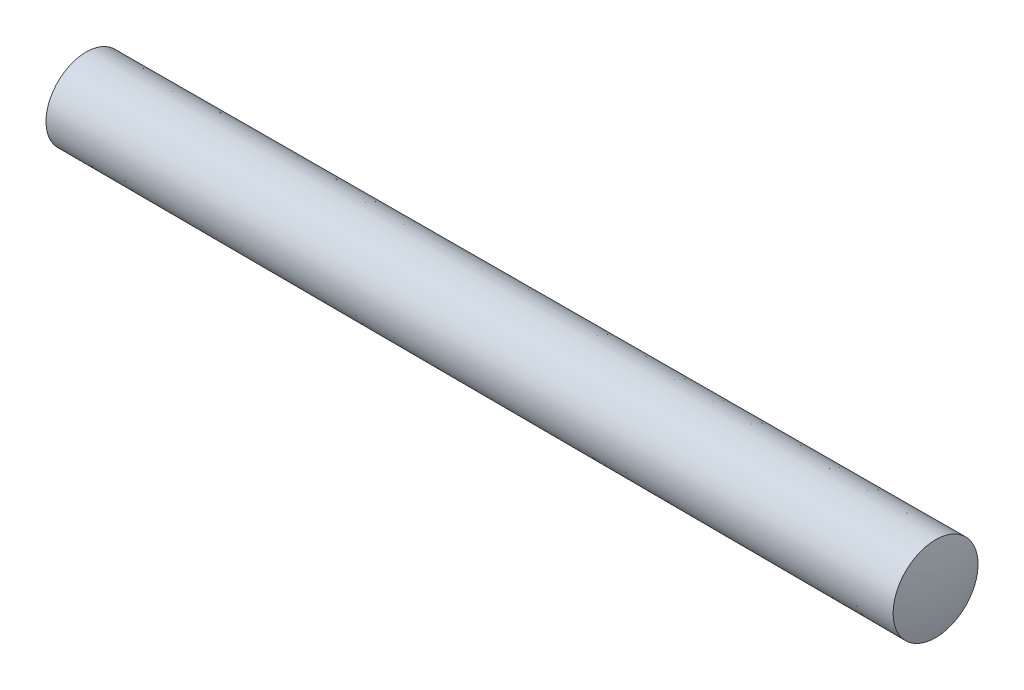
SolidWorks part; units mm, degrees
ref_plane "Front Plane" through (0, 0, 0) normal (0, 0, 1) x (1, 0, 0)
ref_plane "Top Plane" through (0, 0, 0) normal (0, 1, 0) x (1, 0, 0)
ref_plane "Right Plane" through (0, 0, 0) normal (1, 0, 0) x (0, 0, -1)
sketch "BodySke" plane through (0, 0, 0) normal (0, 0, 1) x (1, 0, 0)
  line L0 (-103.4174, 0) -> (209.4275, 0) construction
  line L1 (-0.3618, 0) -> (63.9033, 0)
  line L2 (0, 3.0096) -> (63.5, 3.175)
  line L3 (3.4925, 0) -> (-3.4925, 0) construction
  line L4 (0, 3.0096) -> (0, 0) construction
  line L5 (0, -3.4925) -> (0, 3.4925) construction
  arc A0 (0, 3.0096) -> (-0.3618, 0) centre (12.3382, 0) ccw
  arc A1 (63.5, 3.175) -> (63.9033, 0) centre (51.2033, 0) cw
  dimension "D4" = 12.7
  dimension "D5" = 12.7
  dimension "D2" = 6.0193
  dimension "Diameter" = 6.35
  dimension "Length" = 63.5
revolve "BaseBody" add sketch "BodySke" angle 360 about L0
equation "\"D4@BodySke\" = \"Diameter@BodySke\"*2"
equation "\"D5@BodySke\" = \"Diameter@BodySke\" * 2"
equation "\"D2@BodySke\" = \"Diameter@BodySke\"-\"Diameter@BodySke\" * \"Length@BodySke\" / 48"
